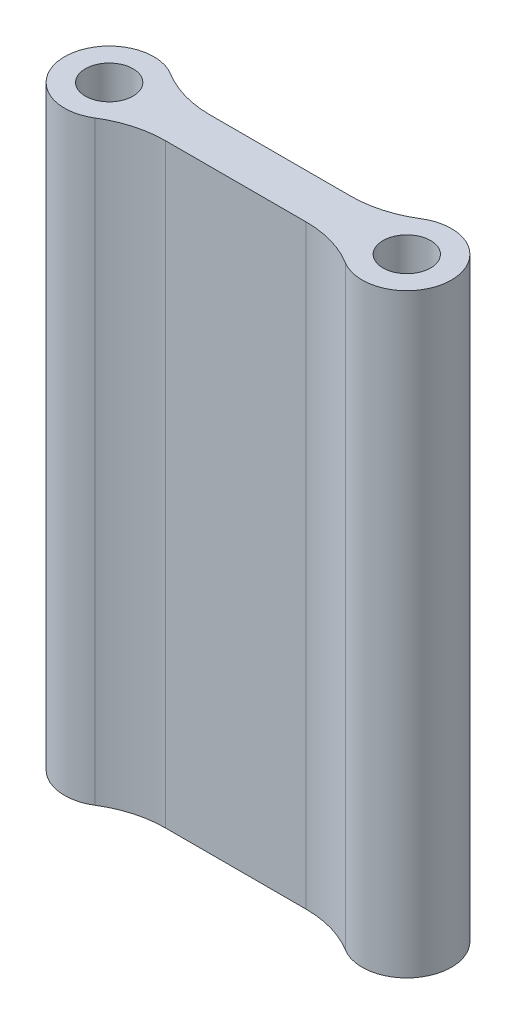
SolidWorks part; units mm, degrees
ref_plane "前视基准面" through (0, 0, 0) normal (0, 0, 1) x (1, 0, 0)
ref_plane "上视基准面" through (0, 0, 0) normal (0, 1, 0) x (1, 0, 0)
ref_plane "右视基准面" through (0, 0, 0) normal (1, 0, 0) x (0, 0, -1)
other "Configuration Table"
sketch "草图1" plane through (0, 0, 0) normal (0, 1, 0) x (1, 0, 0)
  line L0 (5.2678, 1.5) -> (14.7322, 1.5)
  line L3 (14.7322, -1.5) -> (5.2678, -1.5)
  circle A2 centre (0, 0) radius 1.6
  circle A3 centre (20, 0) radius 1.6
  arc A4 (1.5803, -2.55) -> (1.5803, 2.55) centre (0, 0) cw
  arc A5 (18.4197, 2.55) -> (18.4197, -2.55) centre (20, 0) cw
  arc A6 (1.5803, 2.55) -> (5.2678, 1.5) centre (5.2678, 8.5) ccw
  arc A7 (18.4197, 2.55) -> (14.7322, 1.5) centre (14.7322, 8.5) cw
  arc A8 (1.5803, -2.55) -> (5.2678, -1.5) centre (5.2678, -8.5) cw
  arc A9 (18.4197, -2.55) -> (14.7322, -1.5) centre (14.7322, -8.5) ccw
  dimension "D1" = 3.2
  dimension "D3" = 3
  dimension "D4" = 3
  dimension "D5" = 3
  dimension "D6" = 7
  dimension "D2" = 20
extrude "凸台-拉伸1" add sketch "草图1" along normal blind 40
